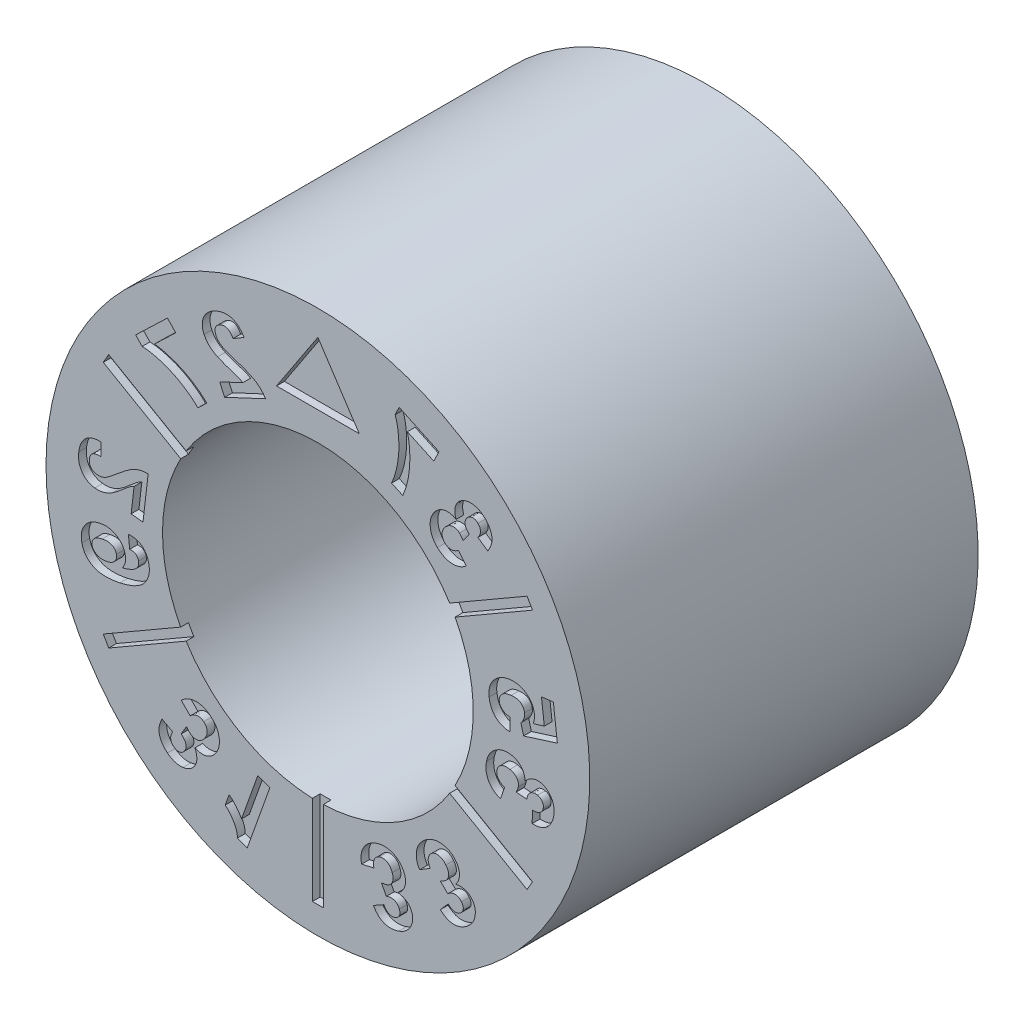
SolidWorks part; units mm, degrees
ref_plane "Front Plane" through (0, 0, 0) normal (0, 0, 1) x (1, 0, 0)
ref_plane "Top Plane" through (0, 0, 0) normal (0, 1, 0) x (1, 0, 0)
ref_plane "Right Plane" through (0, 0, 0) normal (1, 0, 0) x (0, 0, -1)
imported_body "Imported1"
other "Move Face1" parameters "D1"=0.22
other "DeleteFace2"
sketch "Sketch1" plane through (0, 0, 0) normal (0, 0, 1) x (1, 0, 0)
  line L0 (0, 0) -> (0, -3.9447) construction
  line L2 (-0.07, -1.65) -> (0.07, -1.65)
  line L3 (-0.07, -1.65) -> (-0.07, -3.15)
  line L4 (-0.07, -3.15) -> (0.07, -3.15)
  line L5 (0.07, -1.65) -> (0.07, -3.15)
  line L9 (0, 0) -> (-1.9723, -3.4162) construction
  line L10 (-1.4639, -0.7644) -> (-1.3939, -0.8856)
  line L11 (-1.3939, -0.8856) -> (-2.693, -1.6356)
  line L12 (-1.4639, -0.7644) -> (-2.763, -1.5144)
  line L13 (-2.763, -1.5144) -> (-2.693, -1.6356)
  line L14 (0, 0) -> (-3.4162, -1.9723) construction
  line L19 (0, 0) -> (-3.9447, 0) construction
  line L20 (-1.3939, 0.8856) -> (-1.4639, 0.7644)
  line L21 (-1.4639, 0.7644) -> (-2.763, 1.5144)
  line L22 (-1.3939, 0.8856) -> (-2.693, 1.6356)
  line L23 (-2.693, 1.6356) -> (-2.763, 1.5144)
  line L24 (0, 0) -> (-3.4162, 1.9723) construction
  line L29 (0, 0) -> (-1.9723, 3.4162) construction
  line L34 (0, 0) -> (0, 3.9447) construction
  line L39 (0, 0) -> (1.9723, 3.4162) construction
  line L40 (1.4639, 0.7644) -> (1.3939, 0.8856)
  line L41 (1.3939, 0.8856) -> (2.693, 1.6356)
  line L42 (1.4639, 0.7644) -> (2.763, 1.5144)
  line L43 (2.763, 1.5144) -> (2.693, 1.6356)
  line L44 (0, 0) -> (3.4162, 1.9723) construction
  line L49 (0, 0) -> (3.9447, 0) construction
  line L50 (1.3939, -0.8856) -> (1.4639, -0.7644)
  line L51 (1.4639, -0.7644) -> (2.763, -1.5144)
  line L52 (1.3939, -0.8856) -> (2.693, -1.6356)
  line L53 (2.693, -1.6356) -> (2.763, -1.5144)
  line L54 (0, 0) -> (3.4162, -1.9723) construction
  line L59 (0, 0) -> (1.9723, -3.4162) construction
  line L60 (0.07, 3.15) -> (-0.07, 3.15)
  line L61 (0.07, 1.65) -> (0.07, 3.15)
  line L62 (-0.07, 1.65) -> (-0.07, 3.15)
  line L63 (0.07, 1.65) -> (-0.07, 1.65)
  line L64 (-0.7644, 1.4639) -> (-1.5144, 2.763)
  line L65 (-1.5144, 2.763) -> (-1.6356, 2.693)
  line L66 (-0.8856, 1.3939) -> (-1.6356, 2.693)
  line L67 (-0.7644, 1.4639) -> (-0.8856, 1.3939)
  line L68 (0.8856, 1.3939) -> (1.6356, 2.693)
  line L69 (0.8856, 1.3939) -> (0.7644, 1.4639)
  line L70 (0.7644, 1.4639) -> (1.5144, 2.763)
  line L71 (-1.65, 0.07) -> (-3.15, 0.07)
  line L72 (-1.65, -0.07) -> (-3.15, -0.07)
  line L73 (-3.15, 0.07) -> (-3.15, -0.07)
  line L74 (-1.65, 0.07) -> (-1.65, -0.07)
  line L75 (1.65, 0.07) -> (3.15, 0.07)
  line L76 (3.15, -0.07) -> (3.15, 0.07)
  line L77 (1.65, -0.07) -> (3.15, -0.07)
  line L78 (1.65, -0.07) -> (1.65, 0.07)
  line L79 (-0.7644, -1.4639) -> (-1.5144, -2.763)
  line L80 (-0.8856, -1.3939) -> (-1.6356, -2.693)
  line L81 (-1.6356, -2.693) -> (-1.5144, -2.763)
  line L82 (-0.8856, -1.3939) -> (-0.7644, -1.4639)
  line L83 (0.8856, -1.3939) -> (1.6356, -2.693)
  line L84 (0.7644, -1.4639) -> (1.5144, -2.763)
  line L85 (0.7644, -1.4639) -> (0.8856, -1.3939)
  line L86 (1.5144, -2.763) -> (1.6356, -2.693)
  line L87 (1.6356, 2.693) -> (1.5144, 2.763)
  arc A0 (-0.6463, 2.1656) -> (0, 2.26) centre (0, 0) ccw construction
  text T0 "27  29  31  33  35  37" font "Arial" height 0.87
  point P66 (0, 0)
  dimension "D1" = 4.52
  dimension "D6" = 12
extrude "Cut-Extrude1" cut sketch "Sketch1" against normal blind 0.1
